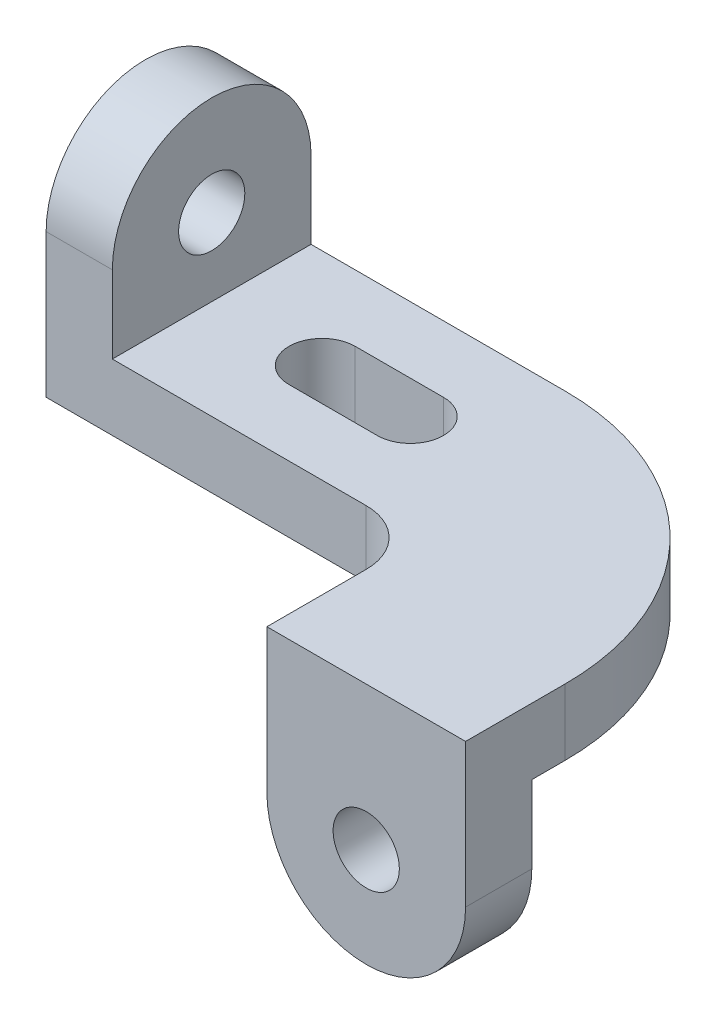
SolidWorks part; units mm, degrees
ref_plane "Front" through (0, 0, 0) normal (0, 0, 1) x (1, 0, 0)
ref_plane "Top" through (0, 0, 0) normal (0, 1, 0) x (1, 0, 0)
ref_plane "Right" through (0, 0, 0) normal (1, 0, 0) x (0, 0, -1)
sketch "Sketch2" plane through (0, 0, 0) normal (0, 1, 0) x (1, 0, 0)
  line L0 (0, 0) -> (92.075, 0)
  line L1 (107.95, -15.875) -> (107.95, -44.45)
  line L2 (107.95, -44.45) -> (165.1, -44.45)
  line L3 (165.1, -44.45) -> (165.1, -15.875)
  line L4 (92.075, 57.15) -> (0, 57.15)
  line L5 (0, 57.15) -> (0, 0)
  arc A0 (107.95, -15.875) -> (92.075, 0) centre (92.075, -15.875) ccw
  arc A1 (165.1, -15.875) -> (92.075, 57.15) centre (92.075, -15.875) ccw
  dimension "D4" = 15.875
  dimension "D5" = 73.025
  dimension "D1" = 165.1
  dimension "D2" = 57.15
  dimension "D3" = 101.6
extrude "Base-Extrude" add sketch "Sketch2" along normal blind 19.05
sketch "Sketch3" plane through (0, 0, 44.45) normal (0, 0, 1) x (1, 0, 0)
  line L1 (107.95, 19.05) -> (165.1, 19.05)
  line L2 (107.95, 19.05) -> (107.95, -22.225)
  line L4 (165.1, 19.05) -> (165.1, -22.225)
  arc A0 (107.95, -22.225) -> (165.1, -22.225) centre (136.525, -22.225) ccw
  dimension "D1" = 69.85
extrude "Boss-Extrude1" add sketch "Sketch3" against normal blind 19.05
sketch "Sketch4" plane through (0, -7.474, -157.6502) normal (1, 0, 0) x (0, 0, 1)
  line L1 (100.5002, -7.474) -> (157.6502, -7.474)
  line L2 (100.5002, -7.474) -> (100.5002, -48.749)
  line L4 (157.6502, -7.474) -> (157.6502, -48.749)
  arc A0 (100.5002, -48.749) -> (157.6502, -48.749) centre (129.0752, -48.749) ccw
  dimension "D1" = 69.85
extrude "Boss-Extrude2" add sketch "Sketch4" along normal blind 19.05
sketch "Sketch5" plane through (0, 0, 44.45) normal (0, 0, 1) x (1, 0, 0)
  circle A0 centre (136.525, -22.225) radius 9.525
  dimension "D1" = 19.05
extrude "Cut-Extrude1" cut sketch "Sketch5" against normal through all
sketch "Sketch6" plane through (0, 63.6844, -158.7244) normal (-1, 0, 0) x (0, 0, 1)
  circle A0 centre (130.1494, -22.4094) radius 9.525
  arc A1 (158.7244, -22.4094) -> (101.5744, -22.4094) centre (130.1494, -22.4094) ccw construction
  dimension "D1" = 19.05
extrude "Cut-Extrude2" cut sketch "Sketch6" against normal through all
sketch "Sketch7" plane through (70.9338, 19.05, -42.4457) normal (0, 1, 0) x (-1, 0, 0)
  line L0 (-5.2662, 13.8707) -> (20.1338, 13.8707) construction
  line L1 (7.4338, 23.3957) -> (7.4338, 4.3457) construction
  line L2 (-5.2662, 23.3957) -> (20.1338, 23.3957)
  line L3 (20.1338, 4.3457) -> (-5.2662, 4.3457)
  line L4 (51.8838, 13.8707) -> (70.9338, 13.8707) construction
  line L5 (51.8838, 42.4457) -> (51.8838, -14.7043) construction
  arc A0 (20.1338, 23.3957) -> (20.1338, 4.3457) centre (20.1338, 13.8707) cw
  arc A1 (-5.2662, 23.3957) -> (-5.2662, 4.3457) centre (-5.2662, 13.8707) ccw
  point P12 (7.4338, 13.8707)
  dimension "D1" = 31.75
  dimension "Slot width" = 19.05
  dimension "Slot length" = 44.45
extrude "slot straight1" cut sketch "Sketch7" against normal through all
